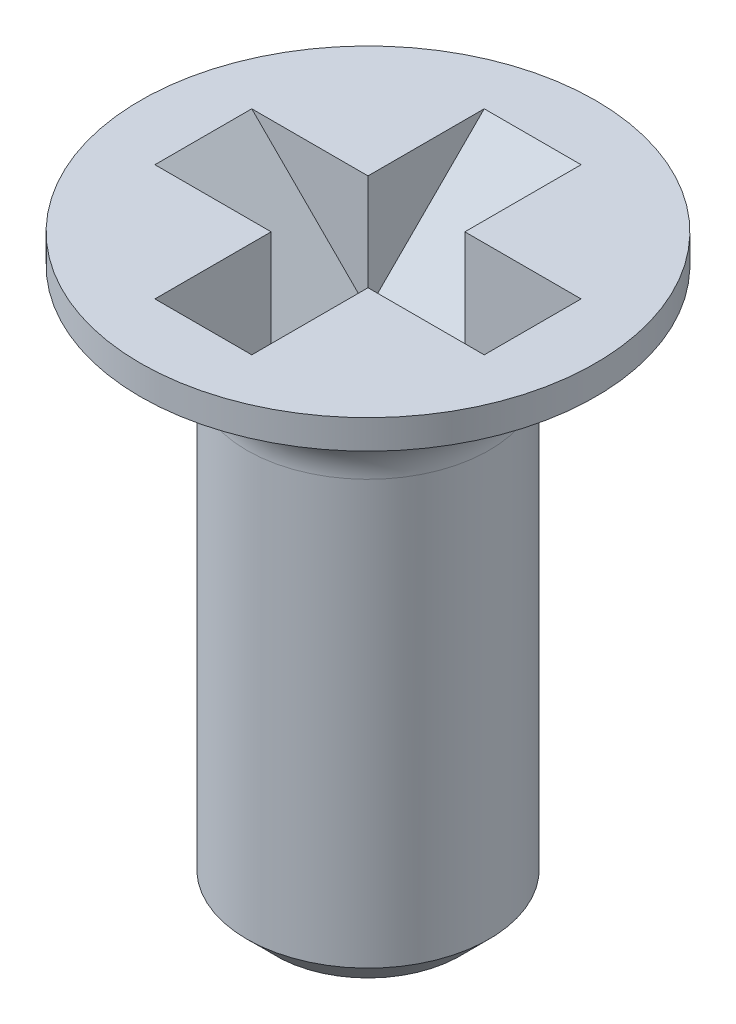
SolidWorks part; units mm, degrees
ref_plane "前视基准面" through (0, 0, 0) normal (0, 0, 1) x (1, 0, 0)
ref_plane "上视基准面" through (0, 0, 0) normal (0, 1, 0) x (1, 0, 0)
ref_plane "右视基准面" through (0, 0, 0) normal (1, 0, 0) x (0, 0, -1)
sketch "草图1" plane through (0, 0, 0) normal (0, 0, 1) x (1, 0, 0)
  line L0 (0, 8.0105) -> (0, -12.1782) construction
  line L1 (0, 0) -> (-2.35, 0)
  line L2 (-2.35, -0.3) -> (-1.5279, -0.8232)
  line L3 (-1.25, -1.3294) -> (-1.25, -6)
  line L4 (-1.25, -6) -> (0, -6)
  line L5 (0, -6) -> (0, 0)
  line L6 (-2.35, 0) -> (-2.35, -0.3)
  arc A0 (-1.25, -1.3294) -> (-1.5279, -0.8232) centre (-1.85, -1.3294) ccw
  point P12 (-1.25, -1)
  dimension "D3" = 1
  dimension "D4" = 0.6
  dimension "D1" = 6
  dimension "D2" = 2.5
  dimension "D5" = 0.3
  dimension "D7" = 4.7
revolve "旋转1" add sketch "草图1" angle 360 about L0
chamfer "倒角1" distance 0.3 angle 45 1 edges at (0, -6, 1.25)
sketch "草图2" plane through (0, 0, 0) normal (0, 0, 1) x (1, 0, 0)
  line L0 (0, 1.2215) -> (0, -1.2) construction
  line L1 (-0.5, -1.2) -> (-1.7, 0)
  line L2 (-1.7, 0) -> (0, 0)
  line L3 (0, 0) -> (0, -1.2)
  line L4 (-0.5, -1.2) -> (0, -1.2)
  line L5 (0, -0.8) -> (0, -5.9417) construction
  dimension "D1" = 1
  dimension "D2" = 1.2
  dimension "D3" = 45
extrude "切除-拉伸1" cut sketch "草图2" against normal mid plane 1
pattern_circular "阵列(圆周)1" count 4 every 90 about axis through (0, 0, 0) along (0, 1, 0) of "切除-拉伸1"
